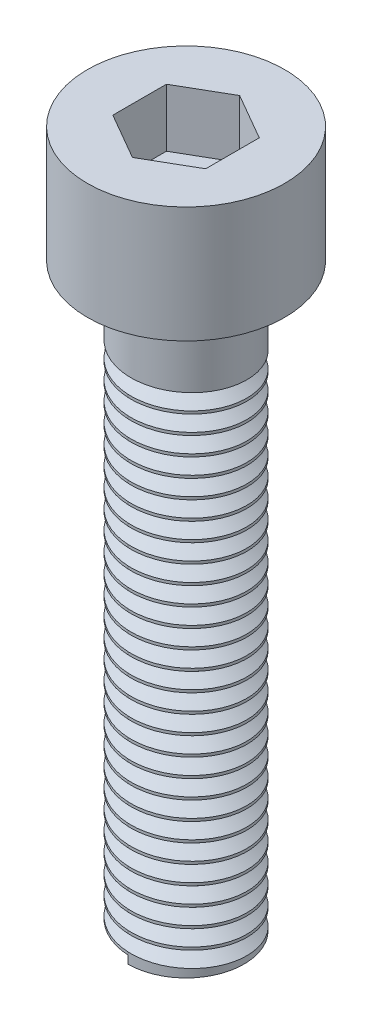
SolidWorks part; units mm, degrees
ref_plane "Alzado" through (0, 0, 0) normal (0, 0, 1) x (1, 0, 0)
ref_plane "Planta" through (0, 0, 0) normal (0, 1, 0) x (1, 0, 0)
ref_plane "Vista lateral" through (0, 0, 0) normal (1, 0, 0) x (0, 0, -1)
sketch "Sk_Cabeza" plane through (0, 0, 0) normal (0, 1, 0) x (1, 0, 0)
  circle A0 centre (0, 0) radius 4.25
  dimension "DIAM1" = 8.5
extrude "Cabeza" add sketch "Sk_Cabeza" along normal blind 5 from offset 0
sketch "Sk_Cana" plane through (0, 0, 0) normal (0, 1, 0) x (1, 0, 0)
  circle A0 centre (0, 0) radius 2.5
  dimension "DIAM2" = 5
extrude "Cana" add sketch "Sk_Cana" along normal blind 25 from offset 25
ref_plane "Plano_cabeza" through (0, 5, 0) normal (0, 1, 0) x (1, 0, 0)
sketch "Sk_Hueco_Allen" plane through (0, 5, 0) normal (0, 1, 0) x (1, 0, 0)
  line L0 (2, -1.1547) -> (0, -2.3094)
  line L1 (0, -2.3094) -> (-2, -1.1547)
  line L2 (-2, -1.1547) -> (-2, 1.1547)
  line L3 (-2, 1.1547) -> (0, 2.3094)
  line L4 (0, 2.3094) -> (2, 1.1547)
  line L5 (2, 1.1547) -> (2, -1.1547)
extrude "Hueco_Allen" cut sketch "Sk_Hueco_Allen" against normal blind 2.5
ref_plane "Plano_punta" through (0, -25, 0) normal (0, 1, 0) x (1, 0, 0)
sketch "Sk_Helice" plane through (0, -25, 0) normal (0, 1, 0) x (1, 0, 0)
  circle A0 centre (0, 0) radius 2.5
curve "Helice_rosca"
sketch "Sk_Perfil_rosca" plane through (0, 0, 0) normal (1, 0, 0) x (0, 0, -1)
  line L0 (-2.7, -25.48) -> (-2.0093, -25)
  line L1 (-2.0093, -25) -> (-2.7, -24.52)
  line L2 (-2.7, -24.52) -> (-2.7, -25.48)
sweep "Rosca_M5x0,8" cut profiles "Sk_Perfil_rosca" path "Helice_rosca"
